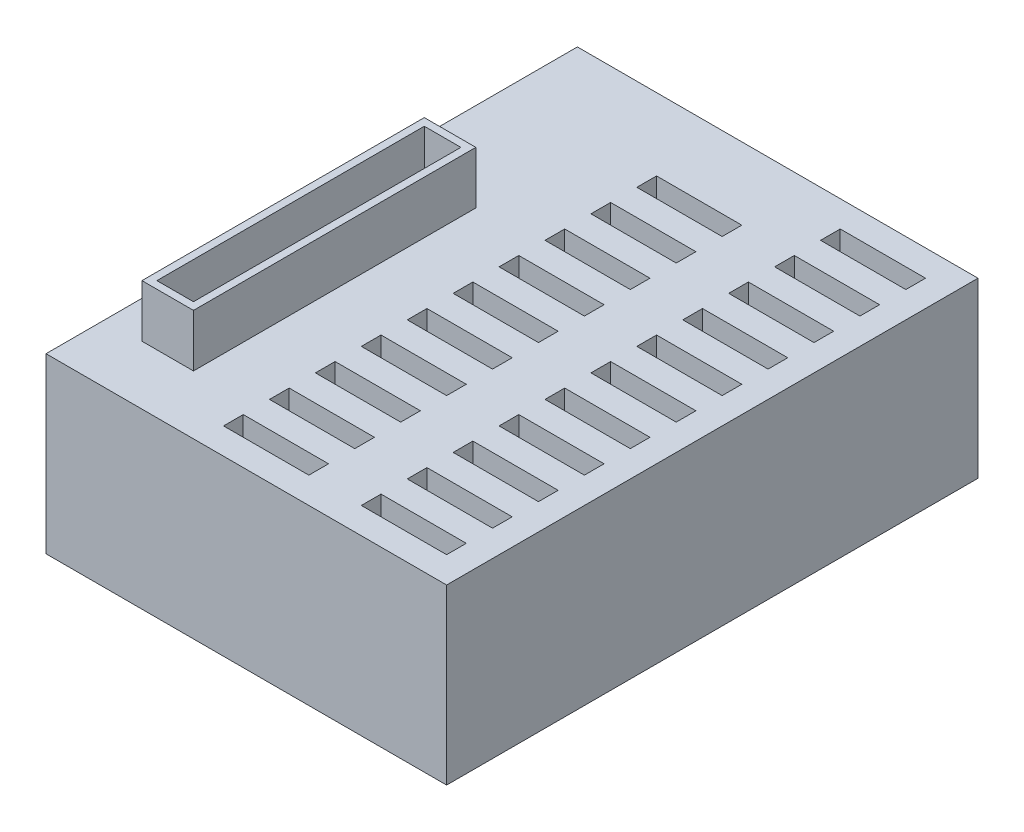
SolidWorks part; units mm, degrees
ref_plane "Front Plane" through (0, 0, 0) normal (0, 0, 1) x (1, 0, 0)
ref_plane "Top Plane" through (0, 0, 0) normal (0, 1, 0) x (1, 0, 0)
ref_plane "Right Plane" through (0, 0, 0) normal (1, 0, 0) x (0, 0, -1)
sketch "Sketch1" plane through (0, 0, 0) normal (0, 1, 0) x (1, 0, 0)
  line L1 (-105.7932, 79.5256) -> (44.2068, 79.5256)
  line L2 (-105.7932, 79.5256) -> (-105.7932, -131.9744)
  line L3 (-105.7932, -131.9744) -> (44.2068, -131.9744)
  line L4 (44.2068, 79.5256) -> (44.2068, -131.9744)
  dimension "D1" = 150
  dimension "D2" = 211.5
extrude "Boss-Extrude1" add sketch "Sketch1" against normal blind 66.04
sketch "Sketch3" plane through (0, 0, 0) normal (0, 1, 0) x (1, 0, 0)
  line L0 (-105.7932, -131.9744) -> (44.2068, -131.9744) construction
  line L1 (-50.7932, -114.4744) -> (-18.2932, -114.4744)
  line L2 (-50.7932, -114.4744) -> (-50.7932, -121.9744)
  line L3 (-50.7932, -121.9744) -> (-18.2932, -121.9744)
  line L4 (-18.2932, -114.4744) -> (-18.2932, -121.9744)
  line L90 (1.7068, -114.4744) -> (1.7068, -121.9744)
  line L91 (1.7068, -114.4744) -> (34.2068, -114.4744)
  line L92 (34.2068, -114.4744) -> (34.2068, -121.9744)
  line L93 (1.7068, -121.9744) -> (34.2068, -121.9744)
  line L94 (1.7068, -96.9744) -> (1.7068, -104.4744)
  line L95 (1.7068, -96.9744) -> (34.2068, -96.9744)
  line L96 (34.2068, -96.9744) -> (34.2068, -104.4744)
  line L97 (1.7068, -104.4744) -> (34.2068, -104.4744)
  line L98 (1.7068, -79.4744) -> (1.7068, -86.9744)
  line L99 (1.7068, -79.4744) -> (34.2068, -79.4744)
  line L100 (34.2068, -79.4744) -> (34.2068, -86.9744)
  line L101 (1.7068, -86.9744) -> (34.2068, -86.9744)
  line L102 (1.7068, -61.9744) -> (1.7068, -69.4744)
  line L103 (1.7068, -61.9744) -> (34.2068, -61.9744)
  line L104 (34.2068, -61.9744) -> (34.2068, -69.4744)
  line L105 (1.7068, -69.4744) -> (34.2068, -69.4744)
  line L106 (1.7068, -44.4744) -> (1.7068, -51.9744)
  line L107 (1.7068, -44.4744) -> (34.2068, -44.4744)
  line L108 (34.2068, -44.4744) -> (34.2068, -51.9744)
  line L109 (1.7068, -51.9744) -> (34.2068, -51.9744)
  line L110 (1.7068, -26.9744) -> (1.7068, -34.4744)
  line L111 (1.7068, -26.9744) -> (34.2068, -26.9744)
  line L112 (34.2068, -26.9744) -> (34.2068, -34.4744)
  line L113 (1.7068, -34.4744) -> (34.2068, -34.4744)
  line L114 (1.7068, -9.4744) -> (1.7068, -16.9744)
  line L115 (1.7068, -9.4744) -> (34.2068, -9.4744)
  line L116 (34.2068, -9.4744) -> (34.2068, -16.9744)
  line L117 (1.7068, -16.9744) -> (34.2068, -16.9744)
  line L118 (1.7068, 8.0256) -> (1.7068, 0.5256)
  line L119 (1.7068, 8.0256) -> (34.2068, 8.0256)
  line L120 (34.2068, 8.0256) -> (34.2068, 0.5256)
  line L121 (1.7068, 0.5256) -> (34.2068, 0.5256)
  line L122 (1.7068, 25.5256) -> (1.7068, 18.0256)
  line L123 (1.7068, 25.5256) -> (34.2068, 25.5256)
  line L124 (34.2068, 25.5256) -> (34.2068, 18.0256)
  line L125 (1.7068, 18.0256) -> (34.2068, 18.0256)
  line L126 (1.7068, 43.0256) -> (1.7068, 35.5256)
  line L127 (1.7068, 43.0256) -> (34.2068, 43.0256)
  line L128 (34.2068, 43.0256) -> (34.2068, 35.5256)
  line L129 (1.7068, 35.5256) -> (34.2068, 35.5256)
  line L130 (1.7068, 60.5256) -> (1.7068, 53.0256)
  line L131 (1.7068, 60.5256) -> (34.2068, 60.5256)
  line L132 (34.2068, 60.5256) -> (34.2068, 53.0256)
  line L133 (1.7068, 53.0256) -> (34.2068, 53.0256)
  line L134 (-50.7932, -96.9744) -> (-50.7932, -104.4744)
  line L135 (-50.7932, -96.9744) -> (-18.2932, -96.9744)
  line L136 (-18.2932, -96.9744) -> (-18.2932, -104.4744)
  line L137 (-50.7932, -104.4744) -> (-18.2932, -104.4744)
  line L138 (-50.7932, -79.4744) -> (-50.7932, -86.9744)
  line L139 (-50.7932, -79.4744) -> (-18.2932, -79.4744)
  line L140 (-18.2932, -79.4744) -> (-18.2932, -86.9744)
  line L141 (-50.7932, -86.9744) -> (-18.2932, -86.9744)
  line L142 (-50.7932, -61.9744) -> (-50.7932, -69.4744)
  line L143 (-50.7932, -61.9744) -> (-18.2932, -61.9744)
  line L144 (-18.2932, -61.9744) -> (-18.2932, -69.4744)
  line L145 (-50.7932, -69.4744) -> (-18.2932, -69.4744)
  line L146 (-50.7932, -44.4744) -> (-50.7932, -51.9744)
  line L147 (-50.7932, -44.4744) -> (-18.2932, -44.4744)
  line L148 (-18.2932, -44.4744) -> (-18.2932, -51.9744)
  line L149 (-50.7932, -51.9744) -> (-18.2932, -51.9744)
  line L150 (-50.7932, -26.9744) -> (-50.7932, -34.4744)
  line L151 (-50.7932, -26.9744) -> (-18.2932, -26.9744)
  line L152 (-18.2932, -26.9744) -> (-18.2932, -34.4744)
  line L153 (-50.7932, -34.4744) -> (-18.2932, -34.4744)
  line L154 (-50.7932, -9.4744) -> (-50.7932, -16.9744)
  line L155 (-50.7932, -9.4744) -> (-18.2932, -9.4744)
  line L156 (-18.2932, -9.4744) -> (-18.2932, -16.9744)
  line L157 (-50.7932, -16.9744) -> (-18.2932, -16.9744)
  line L158 (-50.7932, 8.0256) -> (-50.7932, 0.5256)
  line L159 (-50.7932, 8.0256) -> (-18.2932, 8.0256)
  line L160 (-18.2932, 8.0256) -> (-18.2932, 0.5256)
  line L161 (-50.7932, 0.5256) -> (-18.2932, 0.5256)
  line L162 (-50.7932, 25.5256) -> (-50.7932, 18.0256)
  line L163 (-50.7932, 25.5256) -> (-18.2932, 25.5256)
  line L164 (-18.2932, 25.5256) -> (-18.2932, 18.0256)
  line L165 (-50.7932, 18.0256) -> (-18.2932, 18.0256)
  line L166 (-50.7932, 43.0256) -> (-50.7932, 35.5256)
  line L167 (-50.7932, 43.0256) -> (-18.2932, 43.0256)
  line L168 (-18.2932, 43.0256) -> (-18.2932, 35.5256)
  line L169 (-50.7932, 35.5256) -> (-18.2932, 35.5256)
  line L174 (-50.7932, 53.0256) -> (-18.2932, 53.0256)
  line L175 (-18.2932, 60.5256) -> (-18.2932, 53.0256)
  line L176 (-50.7932, 60.5256) -> (-18.2932, 60.5256)
  line L177 (-50.7932, 60.5256) -> (-50.7932, 53.0256)
  line L180 (44.2068, -131.9744) -> (44.2068, 79.5256) construction
  dimension "D1" = 32.5
  dimension "D2" = 7.5
  dimension "D3" = 10
  dimension "D4" = 2
  dimension "D6" = 20
  dimension "D7" = 10
  dimension "D8" = 10
  dimension "D5" = 11
extrude "Cut-Extrude1" cut sketch "Sketch3" against normal blind 13
sketch "Sketch9" plane through (-105.7932, 0, 0) normal (-1, 0, 0) x (0, 0, 1)
  line L1 (-79.5256, -66.04) -> (131.9744, -66.04)
  line L2 (-79.5256, -66.04) -> (-79.5256, 0)
  line L3 (-79.5256, 0) -> (131.9744, 0)
  line L4 (131.9744, -66.04) -> (131.9744, 0)
extrude "Boss-Extrude4" add sketch "Sketch9" along normal blind 2.667
sketch "Sketch12" plane through (0, 0, 0) normal (0, 1, 0) x (1, 0, 0)
  line L0 (44.2068, -131.9744) -> (44.2068, 79.5256) construction
  line L1 (-108.4602, 79.5256) -> (44.2068, 79.5256)
  line L2 (-108.4602, 79.5256) -> (-108.4602, 76.0256)
  line L3 (-108.4602, 76.0256) -> (44.2068, 76.0256)
  line L4 (44.2068, 79.5256) -> (44.2068, 76.0256)
  dimension "D1" = 3.5
extrude "Cut-Extrude3" cut sketch "Sketch12" against normal through all
sketch "Sketch15" plane through (0, -66.04, 0) normal (0, -1, 0) x (1, 0, 0)
  line L0 (-108.4602, 131.9744) -> (44.2068, 131.9744) construction
  line L1 (-103.4602, 126.9744) -> (39.2068, 126.9744)
  line L2 (-103.4602, 126.9744) -> (-103.4602, -71.0256)
  line L3 (-103.4602, -71.0256) -> (39.2068, -71.0256)
  line L4 (39.2068, 126.9744) -> (39.2068, -71.0256)
  line L5 (-108.4602, -76.0256) -> (44.2068, -76.0256) construction
  line L6 (-108.4602, -76.0256) -> (-108.4602, 131.9744) construction
  line L7 (44.2068, 131.9744) -> (44.2068, -76.0256) construction
  dimension "D1" = 5
  dimension "D2" = 5
  dimension "D3" = 5
  dimension "D4" = 5
extrude "Cut-Extrude4" cut sketch "Sketch15" against normal blind 48
sketch "Sketch17" plane through (0, 0, 0) normal (0, 1, 0) x (1, 0, 0)
  line L0 (44.2068, -131.9744) -> (44.2068, 76.0256) construction
  line L1 (-108.4602, 76.0256) -> (44.2068, 76.0256)
  line L2 (-108.4602, 76.0256) -> (-108.4602, 70.5256)
  line L3 (-108.4602, 70.5256) -> (44.2068, 70.5256)
  line L4 (44.2068, 76.0256) -> (44.2068, 70.5256)
  dimension "D1" = 5.5
extrude "Cut-Extrude6" cut sketch "Sketch17" against normal through all
sketch "Sketch18" plane through (0, -18.04, 0) normal (0, -1, 0) x (1, 0, 0)
  line L0 (39.2068, -70.5256) -> (39.2068, 126.9744) construction
  line L1 (-103.4602, -70.5256) -> (39.2068, -70.5256)
  line L2 (-103.4602, -70.5256) -> (-103.4602, -65.5256)
  line L3 (-103.4602, -65.5256) -> (39.2068, -65.5256)
  line L4 (39.2068, -70.5256) -> (39.2068, -65.5256)
  dimension "D1" = 5
extrude "Boss-Extrude5" add sketch "Sketch18" along normal blind 48
sketch "Sketch22" plane through (-108.4602, 0, 0) normal (-1, 0, 0) x (0, 0, 1)
  line L0 (-70.5256, -66.04) -> (-70.5256, 0) construction
  line L2 (131.9744, 0) -> (-70.5256, 0) construction
  circle A0 centre (-4.8756, -6) radius 1.35
  circle A1 centre (66.3244, -6) radius 1.35
  dimension "D1" = 2.7
  dimension "D2" = 2.7
  dimension "D3" = 71.2
  dimension "D4" = 65.65
  dimension "D5" = 6
  dimension "D6" = 6
extrude "Cut-Extrude8" cut sketch "Sketch22" against normal blind 10
sketch "Sketch23" plane through (0, 0, 0) normal (0, 1, 0) x (1, 0, 0)
  line L0 (-84.4794, -106.5744) -> (-84.4794, -4.9744) construction
  line L1 (-78.0564, -106.5744) -> (-90.9024, -106.5744) construction
  line L2 (-90.9024, -4.9744) -> (-78.0564, -4.9744) construction
  line L3 (-78.0564, -55.7744) -> (-91.6962, -55.7744) construction
  line L4 (-78.0564, -62.9181) -> (-78.0564, -48.6306) construction
  line L5 (-91.6962, -47.0514) -> (-91.6962, -64.4973) construction
  line L7 (-77.6594, -106.5744) -> (-91.2994, -106.5744)
  line L8 (-77.6594, -106.5744) -> (-77.6594, -4.9744)
  line L9 (-77.6594, -4.9744) -> (-91.2994, -4.9744)
  line L10 (-91.2994, -106.5744) -> (-91.2994, -4.9744)
  line L11 (-77.6594, -106.5744) -> (-91.2994, -4.9744) construction
  line L12 (-77.6594, -4.9744) -> (-91.2994, -106.5744) construction
  line L13 (-94.2994, -1.9744) -> (-74.6594, -1.9744)
  line L14 (-94.2994, -1.9744) -> (-94.2994, -109.5744)
  line L15 (-94.2994, -109.5744) -> (-74.6594, -109.5744)
  line L16 (-74.6594, -1.9744) -> (-74.6594, -109.5744)
  line L17 (-94.2994, -1.9744) -> (-74.6594, -109.5744) construction
  line L18 (-94.2994, -109.5744) -> (-74.6594, -1.9744) construction
  line L19 (-91.4494, -4.8244) -> (-77.5094, -4.8244)
  line L20 (-91.4494, -4.8244) -> (-91.4494, -106.7244)
  line L21 (-91.4494, -106.7244) -> (-77.5094, -106.7244)
  line L22 (-77.5094, -4.8244) -> (-77.5094, -106.7244)
  line L23 (-91.4494, -4.8244) -> (-77.5094, -106.7244) construction
  line L24 (-91.4494, -106.7244) -> (-77.5094, -4.8244) construction
  point P12 (-84.4794, -55.7744)
  point P17 (-84.4794, -55.7744)
  point P22 (-84.4794, -55.7744)
  dimension "D1" = 101.6
  dimension "D2" = 13.64
  dimension "D3" = 3
  dimension "D4" = 3
  dimension "D5" = 0.15
  dimension "D6" = 0.15
extrude "Boss-Extrude6" add sketch "Sketch23" along normal blind 20 contours L16 L13 L14 L15 L19 L22 L21 L20
